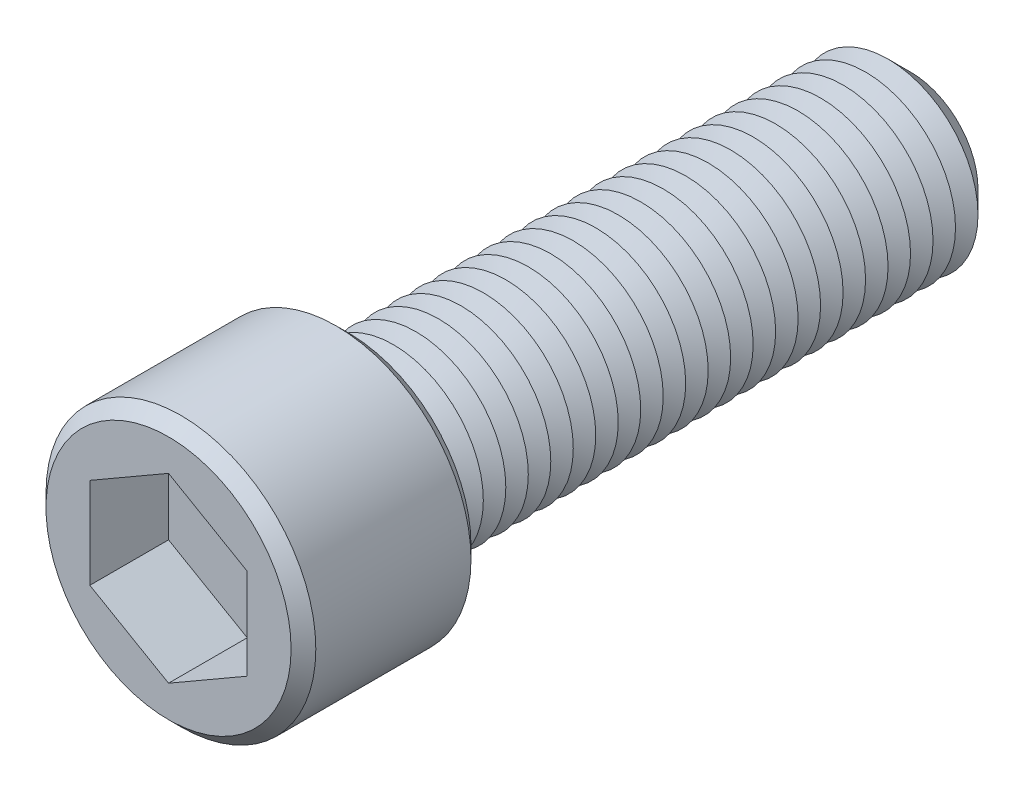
SolidWorks part; units mm, degrees
ref_plane "Front Plane" through (0, 0, 0) normal (0, 0, 1) x (1, 0, 0)
ref_plane "Top Plane" through (0, 0, 0) normal (0, 1, 0) x (1, 0, 0)
ref_plane "Right Plane" through (0, 0, 0) normal (1, 0, 0) x (0, 0, -1)
sketch "Sketch1" plane through (0, 0, 0) normal (0, 0, 1) x (1, 0, 0)
  circle A0 centre (0, 0) radius 12
  dimension "D1" = 24
extrude "Boss-Extrude1" add sketch "Sketch1" along normal blind 16
sketch "Sketch2" plane through (0, 0, 0) normal (0, 0, -1) x (-1, 0, 0)
  circle A0 centre (0, 0) radius 8
  dimension "D1" = 16
extrude "Boss-Extrude2" add sketch "Sketch2" along normal blind 50
chamfer "Chamfer1" distance 2 angle 45 1 edges at (-8, 0, -50)
sketch "Sketch3" plane through (0, 0, 0) normal (1, 0, 0) x (0, 0, -1)
  line L0 (-2.5121, 0) -> (4.5776, 0) construction
sketch "Sketch4" plane through (0, 0, 0) normal (1, 0, 0) x (0, 0, -1)
  line L0 (0, 8) -> (1, 6.2679)
  line L1 (1, 6.2679) -> (2, 8)
  line L2 (48, 8) -> (0, 8) construction
  line L3 (2, 8) -> (0, 8)
  dimension "D1" = 2
revolve "Cut-Revolve1" cut sketch "Sketch4" angle 360 about L0
pattern_linear "LPattern1" count 24 spacing 2 along (0, 0, -1) of "Cut-Revolve1"
sketch "Sketch5" plane through (0, 0, 16) normal (0, 0, 1) x (1, 0, 0)
  line L1 (0, 8.0829) -> (-7, 4.0415)
  line L2 (-7, 4.0415) -> (-7, -4.0415)
  line L3 (-7, -4.0415) -> (0, -8.0829)
  line L4 (0, -8.0829) -> (7, -4.0415)
  line L5 (7, -4.0415) -> (7, 4.0415)
  line L6 (7, 4.0415) -> (0, 8.0829)
  circle A0 centre (0, 0) radius 7 construction
  dimension "D1" = 14
extrude "Cut-Extrude1" cut sketch "Sketch5" against normal blind 7
sketch "Sketch6" plane through (0, 0, 9) normal (0, 0, 1) x (1, 0, 0)
  circle A0 centre (0, 0) radius 0.9
  dimension "D1" = 1.8
extrude "Cut-Extrude2" cut sketch "Sketch6" against normal up to surface (59 mm away)
chamfer "Chamfer2" distance 1.1 angle 45 2 edges at (12, 0, 0) (12, 0, 16)
